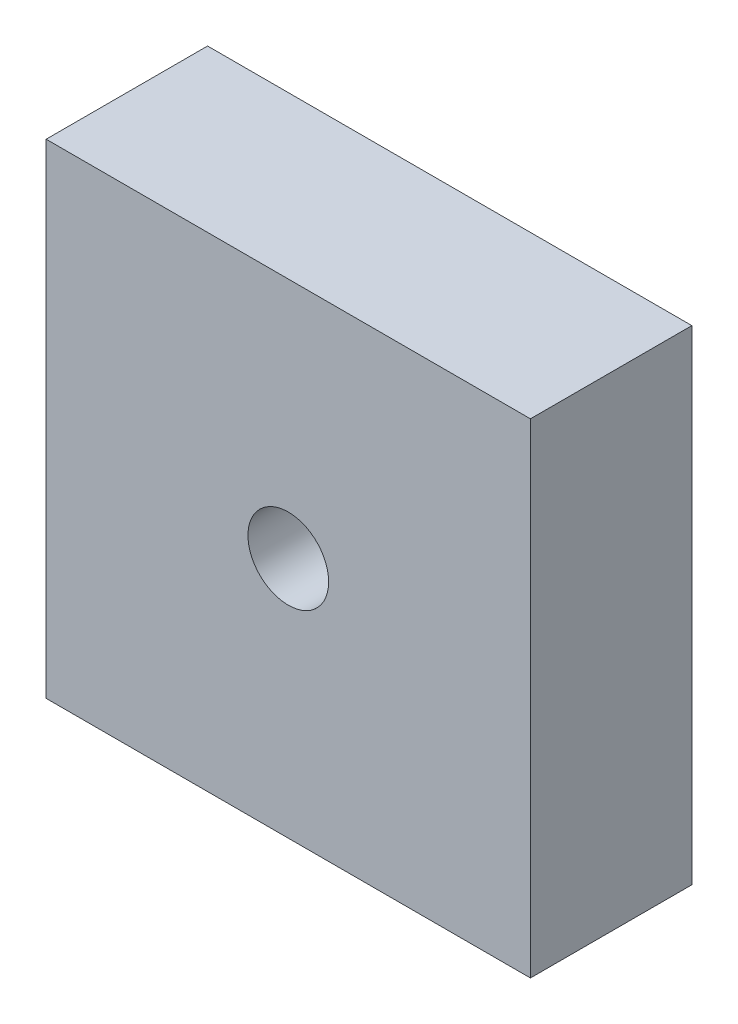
SolidWorks part; units mm, degrees
ref_plane "Alzado" through (0, 0, 0) normal (0, 0, 1) x (1, 0, 0)
ref_plane "Planta" through (0, 0, 0) normal (0, 1, 0) x (1, 0, 0)
ref_plane "Vista lateral" through (0, 0, 0) normal (1, 0, 0) x (0, 0, -1)
sketch "Croquis1" plane through (0, 0, 0) normal (0, 0, 1) x (1, 0, 0)
  line L1 (-15, -15) -> (15, -15)
  line L2 (-15, -15) -> (-15, 15)
  line L3 (-15, 15) -> (15, 15)
  line L4 (15, -15) -> (15, 15)
  line L5 (-15, -15) -> (15, 15) construction
  line L6 (-15, 15) -> (15, -15) construction
  circle A0 centre (0, 0) radius 2.5
  point P0 (0, 0)
  dimension "D2" = 5
  dimension "D1" = 30
extrude "Saliente-Extruir1" add sketch "Croquis1" along normal mid plane 10
